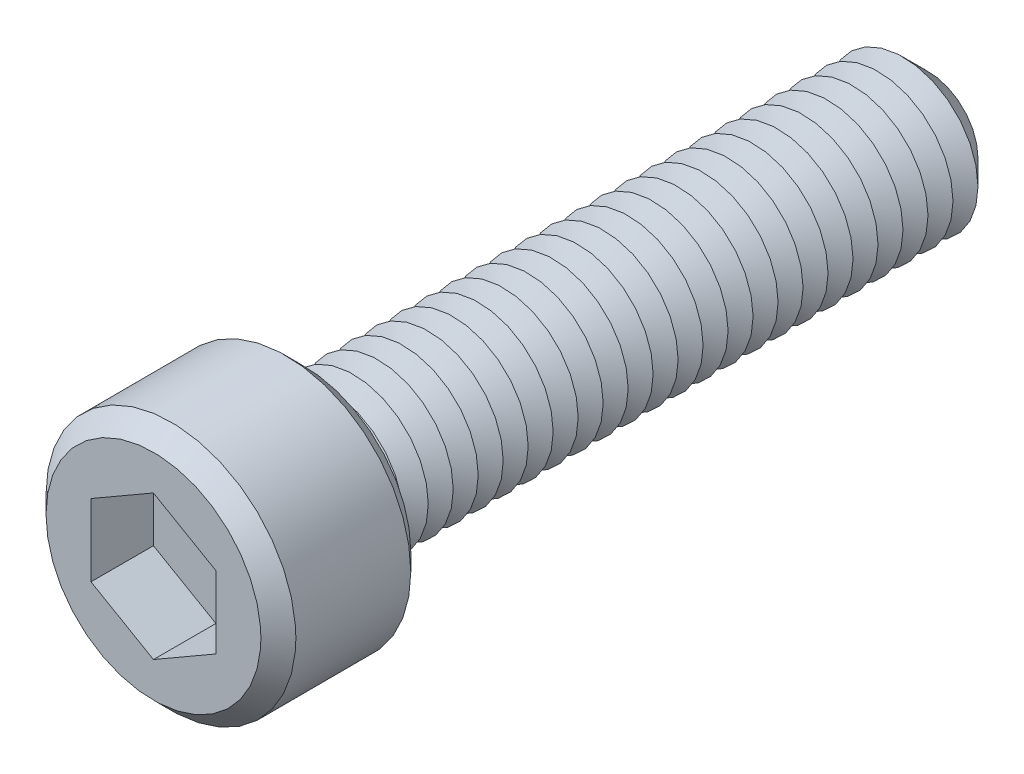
SolidWorks part; units mm, degrees
ref_plane "Front Plane" through (0, 0, 0) normal (0, 0, 1) x (1, 0, 0)
ref_plane "Top Plane" through (0, 0, 0) normal (0, 1, 0) x (1, 0, 0)
ref_plane "Right Plane" through (0, 0, 0) normal (1, 0, 0) x (0, 0, -1)
sketch "Sketch1" plane through (0, 0, 0) normal (0, 0, 1) x (1, 0, 0)
  circle A0 centre (0, 0) radius 5
  dimension "D1" = 10
extrude "Boss-Extrude1" add sketch "Sketch1" along normal blind 6
sketch "Sketch2" plane through (0, 0, 0) normal (0, 0, -1) x (-1, 0, 0)
  circle A0 centre (0, 0) radius 3
  dimension "D1" = 6
extrude "Boss-Extrude2" add sketch "Sketch2" along normal blind 25
chamfer "Chamfer1" distance 1 angle 45 1 edges at (-3, 0, -25)
sketch "Sketch3" plane through (0, 0, 0) normal (1, 0, 0) x (0, 0, -1)
  line L0 (-2.5121, 0) -> (4.5776, 0) construction
sketch "Sketch4" plane through (0, 0, 0) normal (1, 0, 0) x (0, 0, -1)
  line L0 (0, 3) -> (0.5, 2.134)
  line L1 (0.5, 2.134) -> (1, 3)
  line L2 (24, 3) -> (0, 3) construction
  line L3 (1, 3) -> (0, 3)
  dimension "D1" = 1
revolve "Cut-Revolve1" cut sketch "Sketch4" angle 360 about L0
pattern_linear "LPattern1" count 24 spacing 1 along (0, 0, -1) of "Cut-Revolve1"
sketch "Sketch5" plane through (0, 0, 6) normal (0, 0, 1) x (1, 0, 0)
  line L1 (0, 2.8868) -> (-2.5, 1.4434)
  line L2 (-2.5, 1.4434) -> (-2.5, -1.4434)
  line L3 (-2.5, -1.4434) -> (0, -2.8868)
  line L4 (0, -2.8868) -> (2.5, -1.4434)
  line L5 (2.5, -1.4434) -> (2.5, 1.4434)
  line L6 (2.5, 1.4434) -> (0, 2.8868)
  circle A0 centre (0, 0) radius 2.5 construction
  dimension "D1" = 5
extrude "Cut-Extrude1" cut sketch "Sketch5" against normal blind 2.5
sketch "Sketch6" plane through (0, 0, 3.5) normal (0, 0, 1) x (1, 0, 0)
  circle A0 centre (0, 0) radius 0.8
  dimension "D1" = 1.6
extrude "Cut-Extrude2" cut sketch "Sketch6" against normal up to surface (28.5 mm away)
chamfer "Chamfer2" distance 0.7 angle 45 2 edges at (5, 0, 0) (5, 0, 6)
